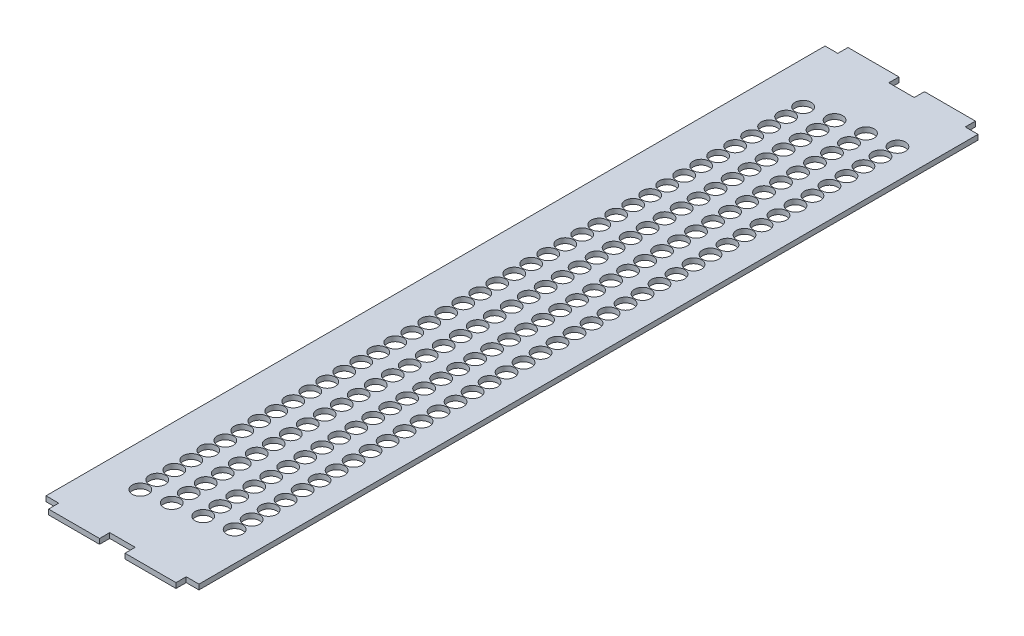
SolidWorks part; units mm, degrees
ref_plane "Alzado" through (0, 0, 0) normal (0, 0, 1) x (1, 0, 0)
ref_plane "Planta" through (0, 0, 0) normal (0, 1, 0) x (1, 0, 0)
ref_plane "Vista lateral" through (0, 0, 0) normal (1, 0, 0) x (0, 0, -1)
sketch "Croquis1" plane through (0, 0, 0) normal (0, 1, 0) x (1, 0, 0)
  line L0 (0, 458.4) -> (7.5, 458.4) construction
  line L1 (0, 0) -> (7.5, 0)
  line L2 (0, 0) -> (0, 458.4)
  line L3 (0, 458.4) -> (7.5, 458.4)
  line L4 (90, 0) -> (90, 458.4)
  line L5 (82.5, 458.4) -> (90, 458.4)
  line L6 (0, 229.2) -> (90, 229.2) construction
  line L7 (37.5, 0) -> (52.5, 0)
  line L8 (82.5, 0) -> (82.5, -6)
  line L9 (82.5, -6) -> (52.5, -6)
  line L10 (7.5, 458.4) -> (7.5, 464.4)
  line L11 (7.5, 464.4) -> (37.5, 464.4)
  line L12 (37.5, 458.4) -> (37.5, 464.4)
  line L13 (82.5, 0) -> (90, 0)
  line L14 (37.5, 458.4) -> (52.5, 458.4)
  line L15 (52.5, 0) -> (52.5, -6)
  line L16 (82.5, 458.4) -> (82.5, 464.4)
  line L17 (82.5, 464.4) -> (52.5, 464.4)
  line L18 (52.5, 458.4) -> (52.5, 464.4)
  line L19 (37.5, 0) -> (37.5, -6)
  line L20 (7.5, 0) -> (7.5, -6)
  line L21 (7.5, -6) -> (37.5, -6)
  circle A0 centre (24.6, 420.9) radius 4.75
  circle A1 centre (40.6, 423.4) radius 4.75
  circle A2 centre (56.6, 425.9) radius 4.75
  circle A3 centre (72.6, 428.4) radius 4.75
  circle A4 centre (24.6, 410.9) radius 4.75
  circle A5 centre (40.6, 413.4) radius 4.75
  circle A6 centre (56.6, 415.9) radius 4.75
  circle A7 centre (72.6, 418.4) radius 4.75
  circle A8 centre (24.6, 400.9) radius 4.75
  circle A9 centre (40.6, 403.4) radius 4.75
  circle A10 centre (56.6, 405.9) radius 4.75
  circle A11 centre (72.6, 408.4) radius 4.75
  circle A12 centre (24.6, 390.9) radius 4.75
  circle A13 centre (40.6, 393.4) radius 4.75
  circle A14 centre (56.6, 395.9) radius 4.75
  circle A15 centre (72.6, 398.4) radius 4.75
  circle A16 centre (24.6, 380.9) radius 4.75
  circle A17 centre (40.6, 383.4) radius 4.75
  circle A18 centre (56.6, 385.9) radius 4.75
  circle A19 centre (72.6, 388.4) radius 4.75
  circle A20 centre (24.6, 370.9) radius 4.75
  circle A21 centre (40.6, 373.4) radius 4.75
  circle A22 centre (56.6, 375.9) radius 4.75
  circle A23 centre (72.6, 378.4) radius 4.75
  circle A24 centre (24.6, 360.9) radius 4.75
  circle A25 centre (40.6, 363.4) radius 4.75
  circle A26 centre (56.6, 365.9) radius 4.75
  circle A27 centre (72.6, 368.4) radius 4.75
  circle A28 centre (24.6, 350.9) radius 4.75
  circle A29 centre (40.6, 353.4) radius 4.75
  circle A30 centre (56.6, 355.9) radius 4.75
  circle A31 centre (72.6, 358.4) radius 4.75
  circle A32 centre (24.6, 340.9) radius 4.75
  circle A33 centre (40.6, 343.4) radius 4.75
  circle A34 centre (56.6, 345.9) radius 4.75
  circle A35 centre (72.6, 348.4) radius 4.75
  circle A36 centre (24.6, 330.9) radius 4.75
  circle A37 centre (40.6, 333.4) radius 4.75
  circle A38 centre (56.6, 335.9) radius 4.75
  circle A39 centre (72.6, 338.4) radius 4.75
  circle A40 centre (24.6, 320.9) radius 4.75
  circle A41 centre (40.6, 323.4) radius 4.75
  circle A42 centre (56.6, 325.9) radius 4.75
  circle A43 centre (72.6, 328.4) radius 4.75
  circle A44 centre (24.6, 310.9) radius 4.75
  circle A45 centre (40.6, 313.4) radius 4.75
  circle A46 centre (56.6, 315.9) radius 4.75
  circle A47 centre (72.6, 318.4) radius 4.75
  circle A48 centre (24.6, 300.9) radius 4.75
  circle A49 centre (40.6, 303.4) radius 4.75
  circle A50 centre (56.6, 305.9) radius 4.75
  circle A51 centre (72.6, 308.4) radius 4.75
  circle A52 centre (24.6, 290.9) radius 4.75
  circle A53 centre (40.6, 293.4) radius 4.75
  circle A54 centre (56.6, 295.9) radius 4.75
  circle A55 centre (72.6, 298.4) radius 4.75
  circle A56 centre (24.6, 280.9) radius 4.75
  circle A57 centre (40.6, 283.4) radius 4.75
  circle A58 centre (56.6, 285.9) radius 4.75
  circle A59 centre (72.6, 288.4) radius 4.75
  circle A60 centre (24.6, 270.9) radius 4.75
  circle A61 centre (40.6, 273.4) radius 4.75
  circle A62 centre (56.6, 275.9) radius 4.75
  circle A63 centre (72.6, 278.4) radius 4.75
  circle A64 centre (24.6, 260.9) radius 4.75
  circle A65 centre (40.6, 263.4) radius 4.75
  circle A66 centre (56.6, 265.9) radius 4.75
  circle A67 centre (72.6, 268.4) radius 4.75
  circle A68 centre (24.6, 250.9) radius 4.75
  circle A69 centre (40.6, 253.4) radius 4.75
  circle A70 centre (56.6, 255.9) radius 4.75
  circle A71 centre (72.6, 258.4) radius 4.75
  circle A72 centre (24.6, 240.9) radius 4.75
  circle A73 centre (40.6, 243.4) radius 4.75
  circle A74 centre (56.6, 245.9) radius 4.75
  circle A75 centre (72.6, 248.4) radius 4.75
  circle A76 centre (24.6, 230.9) radius 4.75
  circle A77 centre (40.6, 233.4) radius 4.75
  circle A78 centre (56.6, 235.9) radius 4.75
  circle A79 centre (72.6, 238.4) radius 4.75
  circle A80 centre (24.6, 220.9) radius 4.75
  circle A81 centre (40.6, 223.4) radius 4.75
  circle A82 centre (56.6, 225.9) radius 4.75
  circle A83 centre (72.6, 228.4) radius 4.75
  circle A84 centre (24.6, 210.9) radius 4.75
  circle A85 centre (40.6, 213.4) radius 4.75
  circle A86 centre (56.6, 215.9) radius 4.75
  circle A87 centre (72.6, 218.4) radius 4.75
  circle A88 centre (24.6, 200.9) radius 4.75
  circle A89 centre (40.6, 203.4) radius 4.75
  circle A90 centre (56.6, 205.9) radius 4.75
  circle A91 centre (72.6, 208.4) radius 4.75
  circle A92 centre (24.6, 190.9) radius 4.75
  circle A93 centre (40.6, 193.4) radius 4.75
  circle A94 centre (56.6, 195.9) radius 4.75
  circle A95 centre (72.6, 198.4) radius 4.75
  circle A96 centre (24.6, 180.9) radius 4.75
  circle A97 centre (40.6, 183.4) radius 4.75
  circle A98 centre (56.6, 185.9) radius 4.75
  circle A99 centre (72.6, 188.4) radius 4.75
  circle A100 centre (24.6, 170.9) radius 4.75
  circle A101 centre (40.6, 173.4) radius 4.75
  circle A102 centre (56.6, 175.9) radius 4.75
  circle A103 centre (72.6, 178.4) radius 4.75
  circle A104 centre (24.6, 160.9) radius 4.75
  circle A105 centre (40.6, 163.4) radius 4.75
  circle A106 centre (56.6, 165.9) radius 4.75
  circle A107 centre (72.6, 168.4) radius 4.75
  circle A108 centre (24.6, 150.9) radius 4.75
  circle A109 centre (40.6, 153.4) radius 4.75
  circle A110 centre (56.6, 155.9) radius 4.75
  circle A111 centre (72.6, 158.4) radius 4.75
  circle A112 centre (24.6, 140.9) radius 4.75
  circle A113 centre (40.6, 143.4) radius 4.75
  circle A114 centre (56.6, 145.9) radius 4.75
  circle A115 centre (72.6, 148.4) radius 4.75
  circle A116 centre (24.6, 130.9) radius 4.75
  circle A117 centre (40.6, 133.4) radius 4.75
  circle A118 centre (56.6, 135.9) radius 4.75
  circle A119 centre (72.6, 138.4) radius 4.75
  circle A120 centre (24.6, 120.9) radius 4.75
  circle A121 centre (40.6, 123.4) radius 4.75
  circle A122 centre (56.6, 125.9) radius 4.75
  circle A123 centre (72.6, 128.4) radius 4.75
  circle A124 centre (24.6, 110.9) radius 4.75
  circle A125 centre (40.6, 113.4) radius 4.75
  circle A126 centre (56.6, 115.9) radius 4.75
  circle A127 centre (72.6, 118.4) radius 4.75
  circle A128 centre (24.6, 100.9) radius 4.75
  circle A129 centre (40.6, 103.4) radius 4.75
  circle A130 centre (56.6, 105.9) radius 4.75
  circle A131 centre (72.6, 108.4) radius 4.75
  circle A132 centre (24.6, 90.9) radius 4.75
  circle A133 centre (40.6, 93.4) radius 4.75
  circle A134 centre (56.6, 95.9) radius 4.75
  circle A135 centre (72.6, 98.4) radius 4.75
  circle A136 centre (24.6, 80.9) radius 4.75
  circle A137 centre (40.6, 83.4) radius 4.75
  circle A138 centre (56.6, 85.9) radius 4.75
  circle A139 centre (72.6, 88.4) radius 4.75
  circle A140 centre (24.6, 70.9) radius 4.75
  circle A141 centre (40.6, 73.4) radius 4.75
  circle A142 centre (56.6, 75.9) radius 4.75
  circle A143 centre (72.6, 78.4) radius 4.75
  circle A144 centre (24.6, 60.9) radius 4.75
  circle A145 centre (40.6, 63.4) radius 4.75
  circle A146 centre (56.6, 65.9) radius 4.75
  circle A147 centre (72.6, 68.4) radius 4.75
  circle A148 centre (24.6, 50.9) radius 4.75
  circle A149 centre (40.6, 53.4) radius 4.75
  circle A150 centre (56.6, 55.9) radius 4.75
  circle A151 centre (72.6, 58.4) radius 4.75
  circle A152 centre (24.6, 40.9) radius 4.75
  circle A153 centre (40.6, 43.4) radius 4.75
  circle A154 centre (56.6, 45.9) radius 4.75
  circle A155 centre (72.6, 48.4) radius 4.75
  circle A156 centre (24.6, 30.9) radius 4.75
  circle A157 centre (40.6, 33.4) radius 4.75
  circle A158 centre (56.6, 35.9) radius 4.75
  circle A159 centre (72.6, 38.4) radius 4.75
  dimension "D6" = 9.5
  dimension "D9" = 9.5
  dimension "D12" = 9.5
  dimension "D15" = 9.5
  dimension "D19" = 24.6
  dimension "D20" = 127.5
  dimension "D1" = 458.4
  dimension "D2" = 90
  dimension "D3" = 7.5
  dimension "D4" = 7.5
  dimension "D5" = 6
  dimension "D7" = 24.6
  dimension "D8" = 37.5
  dimension "D10" = 2.5
  dimension "D11" = 16
  dimension "D13" = 16
  dimension "D14" = 2.5
  dimension "D16" = 2.5
  dimension "D17" = 16
  dimension "D21" = 30
  dimension "D22" = 30
  dimension "D23" = 6
  dimension "D24" = 458.4
  dimension "D18" = 40
extrude "Saliente-Extruir1" add sketch "Croquis1" along normal blind 3
